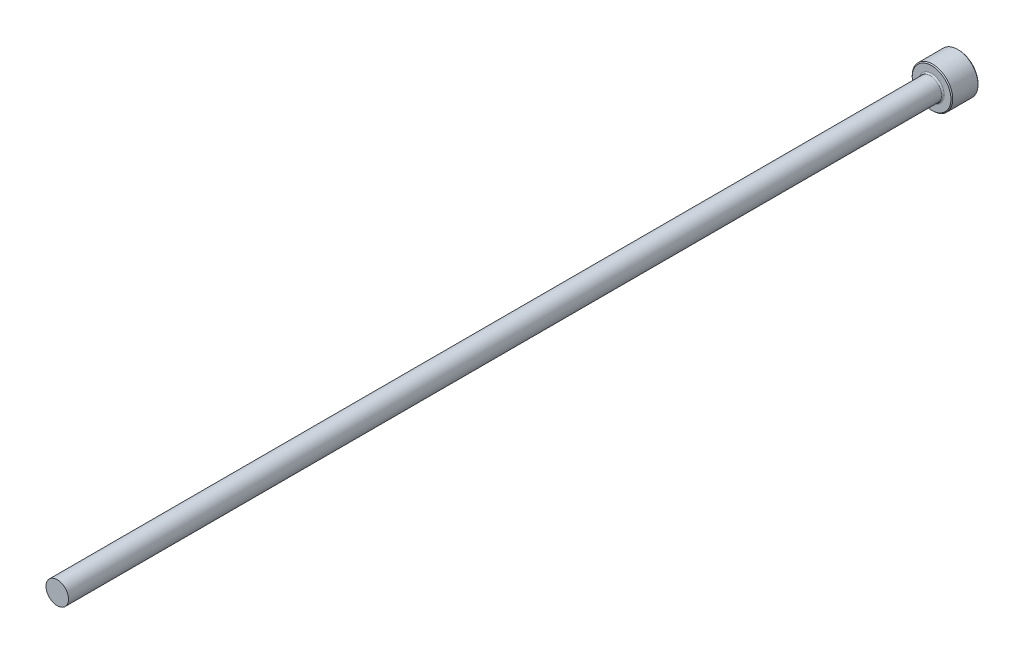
SolidWorks part; units mm, degrees
ref_plane "Front Plane" through (0, 0, 0) normal (0, 0, 1) x (1, 0, 0)
ref_plane "Top Plane" through (0, 0, 0) normal (0, 1, 0) x (1, 0, 0)
ref_plane "Right Plane" through (0, 0, 0) normal (1, 0, 0) x (0, 0, -1)
sketch "Sketch1" plane through (0, 0, 0) normal (1, 0, 0) x (0, 0, -1)
  line L0 (0, 0) -> (0, 4.5)
  line L1 (0, 4.4) -> (0, -4.4) construction
  line L2 (0, 4.5) -> (-6, 4.5)
  line L3 (-6, 4.5) -> (-6, 2.8)
  line L4 (-6.3, 2.5) -> (-200, 2.5)
  line L5 (-200, 2.5) -> (-200, 0)
  line L6 (4.4, 0) -> (-4.4, 0) construction
  line L7 (-200, 0) -> (0, 0)
  line L8 (-109.0506, 0) -> (16.9928, 0) construction
  arc A0 (-6, 2.8) -> (-6.3, 2.5) centre (-6.3, 2.8) cw
  dimension "D1" = 0.3
  dimension "D2" = 9
  dimension "D3" = 5
  dimension "D4" = 200
  dimension "D5" = 6
revolve "Revolve1" add sketch "Sketch1" angle 360 about L8
chamfer "Chamfer1" distance 0.2 angle 45 2 edges at (4.5, 0, 0) (4.5, 0, 6)
